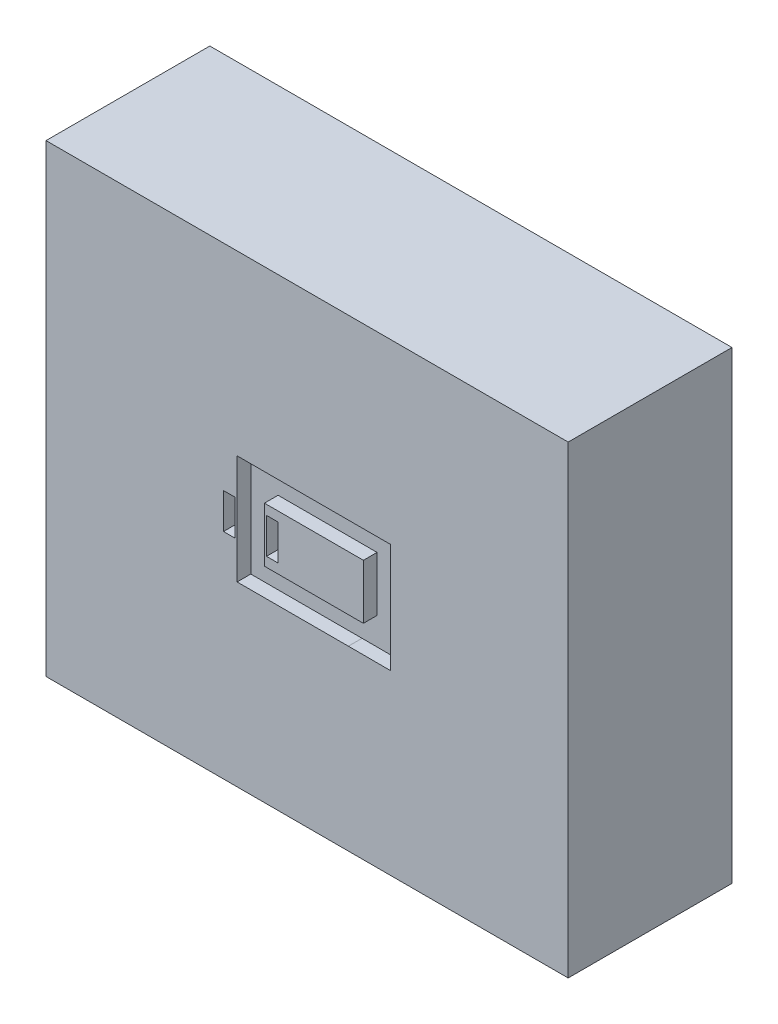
SolidWorks part; units mm, degrees
ref_plane "Front Plane" through (0, 0, 0) normal (0, 0, 1) x (1, 0, 0)
ref_plane "Top Plane" through (0, 0, 0) normal (0, 1, 0) x (1, 0, 0)
ref_plane "Right Plane" through (0, 0, 0) normal (1, 0, 0) x (0, 0, -1)
sketch "Sketch1" plane through (0, 0, 0) normal (0, 0, 1) x (1, 0, 0)
  line L1 (-205.4783, 157.7339) -> (177.0217, 157.7339)
  line L2 (-205.4783, 157.7339) -> (-205.4783, -182.2661)
  line L3 (-205.4783, -182.2661) -> (177.0217, -182.2661)
  line L4 (177.0217, 157.7339) -> (177.0217, -182.2661)
  line L5 (-65.4783, -52.2661) -> (14.5217, -52.2661) construction
  line L6 (47.0217, -52.3228) -> (47.0217, 27.7339) construction
  line L7 (14.5217, 27.7339) -> (-65.4783, 27.7339) construction
  line L8 (-75.4783, 0.7339) -> (-75.4783, -25.2661) construction
  dimension "D1" = 130
  dimension "D2" = 130
  dimension "D3" = 130
  dimension "D4" = 130
extrude "Extrude1" add sketch "Sketch1" against normal blind 120
other "Cavity1"
other "Air Gap 2<1>@Force on a Magnetic Circuit1"
other "Air Gap 1<1>@Force on a Magnetic Circuit1"
other "Coil<1>@Force on a Magnetic Circuit1"
other "Movable piece<1>@Force on a Magnetic Circuit1"
other "Body<1>@Force on a Magnetic Circuit1"
